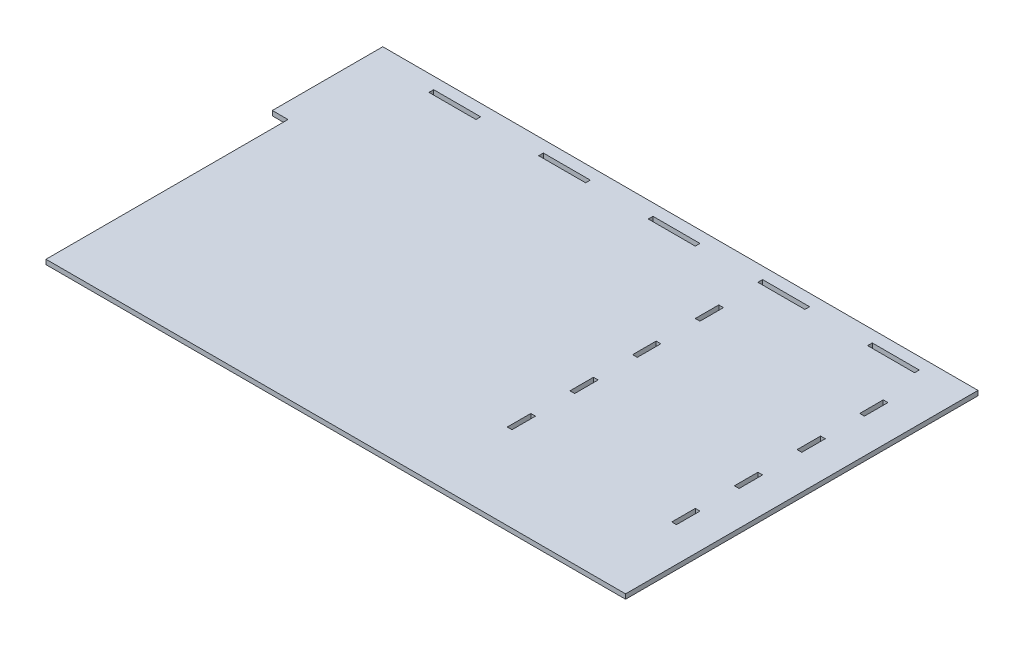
SolidWorks part; units mm, degrees
ref_plane "Front Plane" through (0, 0, 0) normal (0, 0, 1) x (1, 0, 0)
ref_plane "Top Plane" through (0, 0, 0) normal (0, 1, 0) x (1, 0, 0)
ref_plane "Right Plane" through (0, 0, 0) normal (1, 0, 0) x (0, 0, -1)
sketch "Sketch1" plane through (0, 0, 0) normal (0, 1, 0) x (1, 0, 0)
  line L0 (0, 0) -> (0, 225)
  line L1 (0, 225) -> (390, 225)
  line L2 (390, 225) -> (390, 0)
  line L3 (390, 0) -> (0, 0)
extrude "Boss-Extrude1" add sketch "Sketch1" along normal blind 3
sketch "Sketch2" plane through (0, 3, 0) normal (0, 1, 0) x (1, 0, 0)
  line L0 (0, 217.5) -> (0, 225) construction
  line L1 (0, 225) -> (0, 0) construction
  line L2 (350, 217.5) -> (390, 217.5) construction
  line L4 (0, 217.5) -> (40, 217.5) construction
  line L5 (40, 217.5) -> (70, 217.5) construction
  line L6 (70, 217.5) -> (110, 217.5) construction
  line L7 (110, 217.5) -> (140, 217.5) construction
  line L8 (140, 217.5) -> (180, 217.5) construction
  line L9 (180, 217.5) -> (210, 217.5) construction
  line L10 (210, 217.5) -> (250, 217.5) construction
  line L11 (250, 217.5) -> (280, 217.5) construction
  line L12 (280, 217.5) -> (320, 217.5) construction
  line L13 (320, 217.5) -> (350, 217.5) construction
  line L15 (40, 217.5) -> (70, 217.5)
  line L16 (70, 217.5) -> (70, 214.5)
  line L17 (70, 214.5) -> (40, 214.5)
  line L18 (40, 214.5) -> (40, 217.5)
  line L19 (140, 217.5) -> (110, 217.5)
  line L20 (110, 217.5) -> (110, 214.5)
  line L21 (110, 214.5) -> (140, 214.5)
  line L22 (140, 214.5) -> (140, 217.5)
  line L23 (180, 217.5) -> (210, 217.5)
  line L24 (210, 217.5) -> (210, 214.5)
  line L25 (210, 214.5) -> (180, 214.5)
  line L26 (180, 214.5) -> (180, 217.5)
  line L27 (280, 217.5) -> (250, 217.5)
  line L28 (250, 217.5) -> (250, 214.5)
  line L29 (250, 214.5) -> (280, 214.5)
  line L30 (280, 214.5) -> (280, 217.5)
  line L31 (320, 217.5) -> (350, 217.5)
  line L32 (350, 214.5) -> (320, 214.5)
  line L33 (320, 214.5) -> (320, 217.5)
  line L34 (350, 217.5) -> (350, 214.5)
  line L35 (390, 0) -> (390, 225) construction
  dimension "D1" = 40
  dimension "D2" = 30
  dimension "D3" = 40
  dimension "D4" = 30
  dimension "D5" = 40
  dimension "D6" = 30
  dimension "D7" = 40
  dimension "D8" = 30
  dimension "D9" = 40
  dimension "D10" = 30
  dimension "D11" = 7.5
extrude "Cut-Extrude1" cut sketch "Sketch2" against normal blind 3
sketch "Sketch4" plane through (0, 3, 0) normal (0, 1, 0) x (1, 0, 0)
  line L0 (390, 225) -> (390, 0)
  line L1 (390, 0) -> (380, 0)
  line L2 (0, 0) -> (390, 0) construction
  line L3 (380, 0) -> (380, 225)
  line L4 (390, 225) -> (0, 225) construction
  line L5 (380, 225) -> (390, 225)
extrude "Cut-Extrude2" cut sketch "Sketch4" against normal blind 10
sketch "Sketch9" plane through (0, 3, 0) normal (0, 1, 0) x (1, 0, 0)
  line L0 (40, 214.5) -> (0, 214.5) construction
  line L1 (0, 225) -> (0, 0) construction
  line L7 (0, 214.5) -> (0, 154.5) construction
  line L8 (0, 154.5) -> (10, 154.5)
  line L9 (10, 154.5) -> (10, 0)
  line L10 (0, 0) -> (380, 0) construction
  line L11 (10, 0) -> (0, 0)
  line L12 (0, 0) -> (0, 154.5)
extrude "Cut-Extrude6" cut sketch "Sketch9" against normal blind 10
sketch "Sketch10" plane through (0, 3, 0) normal (0, 1, 0) x (1, 0, 0)
  line L0 (250, 214.5) -> (250, 189.5) construction
  line L1 (250, 189.5) -> (250, 174.5) construction
  line L2 (250, 174.5) -> (250, 149.5) construction
  line L3 (250, 149.5) -> (250, 134.5) construction
  line L4 (250, 134.5) -> (250, 109.5) construction
  line L5 (250, 109.5) -> (250, 94.5) construction
  line L6 (250, 94.5) -> (250, 69.5) construction
  line L7 (250, 69.5) -> (250, 54.5) construction
  line L8 (250, 189.5) -> (253, 189.5)
  line L9 (253, 189.5) -> (253, 174.5)
  line L10 (253, 174.5) -> (250, 174.5)
  line L11 (250, 174.5) -> (250, 189.5)
  line L12 (250, 149.5) -> (250, 134.5)
  line L13 (250, 134.5) -> (253, 134.5)
  line L14 (253, 134.5) -> (253, 149.5)
  line L15 (253, 149.5) -> (250, 149.5)
  line L16 (250, 109.5) -> (250, 94.5)
  line L17 (250, 94.5) -> (253, 94.5)
  line L18 (253, 94.5) -> (253, 109.5)
  line L19 (253, 109.5) -> (250, 109.5)
  line L20 (250, 69.5) -> (250, 54.5)
  line L21 (250, 54.5) -> (253, 54.5)
  line L22 (253, 54.5) -> (253, 69.5)
  line L23 (253, 69.5) -> (250, 69.5)
  line L24 (253, 142) -> (355, 142) construction
  line L25 (304, 142) -> (304, 44.6475) construction
  line L26 (358, 69.5) -> (358, 54.5) construction
  line L27 (358, 94.5) -> (358, 69.5) construction
  line L28 (358, 109.5) -> (358, 94.5) construction
  line L29 (358, 134.5) -> (358, 109.5) construction
  line L30 (358, 149.5) -> (358, 134.5) construction
  line L31 (358, 174.5) -> (358, 149.5) construction
  line L32 (358, 189.5) -> (358, 174.5) construction
  line L33 (355, 69.5) -> (358, 69.5)
  line L34 (355, 54.5) -> (355, 69.5)
  line L35 (358, 54.5) -> (355, 54.5)
  line L36 (358, 69.5) -> (358, 54.5)
  line L37 (355, 109.5) -> (358, 109.5)
  line L38 (355, 94.5) -> (355, 109.5)
  line L39 (358, 94.5) -> (355, 94.5)
  line L40 (358, 109.5) -> (358, 94.5)
  line L41 (355, 149.5) -> (358, 149.5)
  line L42 (355, 134.5) -> (355, 149.5)
  line L43 (358, 134.5) -> (355, 134.5)
  line L44 (358, 149.5) -> (358, 134.5)
  line L45 (358, 174.5) -> (358, 189.5)
  line L46 (355, 174.5) -> (358, 174.5)
  line L47 (355, 189.5) -> (355, 174.5)
  line L48 (358, 189.5) -> (355, 189.5)
  dimension "D1" = 25
  dimension "D2" = 15
  dimension "D3" = 25
  dimension "D4" = 15
  dimension "D5" = 25
  dimension "D6" = 15
  dimension "D7" = 25
  dimension "D8" = 15
extrude "Cut-Extrude7" cut sketch "Sketch10" against normal blind 10
